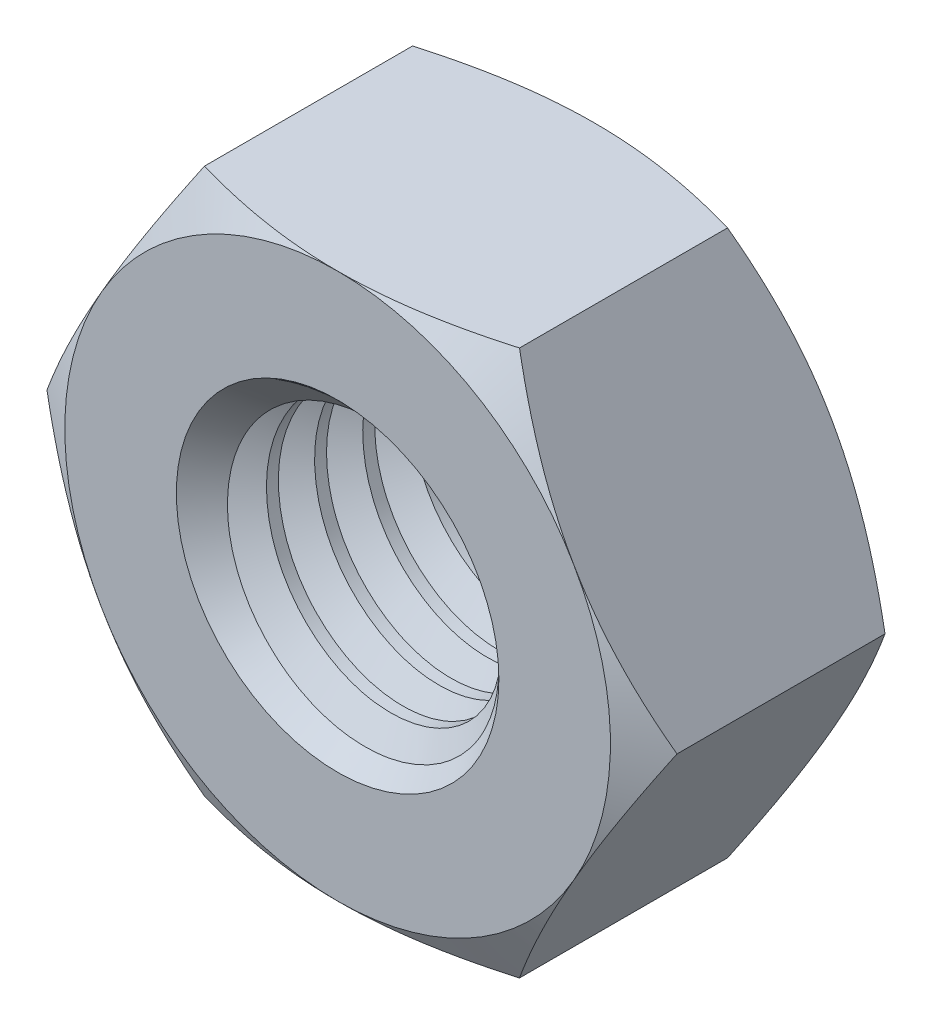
SolidWorks part; units mm, degrees
ref_plane "Front" through (0, 0, 0) normal (0, 0, 1) x (1, 0, 0)
ref_plane "Top" through (0, 0, 0) normal (0, 1, 0) x (1, 0, 0)
ref_plane "Right" through (0, 0, 0) normal (1, 0, 0) x (0, 0, -1)
sketch "Çizim1" plane through (0, 0, 0) normal (0, 0, 1) x (1, 0, 0)
  line L1 (9.815, 0) -> (4.9075, 8.5)
  line L2 (4.9075, 8.5) -> (-4.9075, 8.5)
  line L3 (-4.9075, 8.5) -> (-9.815, 0)
  line L4 (-9.815, 0) -> (-4.9075, -8.5)
  line L5 (-4.9075, -8.5) -> (4.9075, -8.5)
  line L6 (4.9075, -8.5) -> (9.815, 0)
  circle A0 centre (0, 0) radius 8.5 construction
  dimension "D1" = 17
extrude "Yükseklik-Ekstrüzyon1" add sketch "Çizim1" along normal blind 8
sketch "Çizim2" plane through (0, 0, 8) normal (0, 0, 1) x (1, 0, 0)
  circle A0 centre (0, 0) radius 8.5
extrude "Kes-Ekstrüzyon1" cut sketch "Çizim2" against normal blind 8 draft 60 flip side to cut
sketch "Çizim3" plane through (0, 0, 0) normal (0, 0, -1) x (-1, 0, 0)
  circle A0 centre (0, 0) radius 8.5
extrude "Kes-Ekstrüzyon2" cut sketch "Çizim3" against normal blind 8 draft 60 flip side to cut
sketch "Çizim4" plane through (0, 0, 0) normal (0, 0, -1) x (-1, 0, 0)
  circle A0 centre (0, 0) radius 4.025
  dimension "D1" = 8.05
extrude "Kes-Ekstrüzyon3" cut sketch "Çizim4" against normal blind 28
sketch "Çizim5" plane through (0, 0, 0) normal (0, 0, -1) x (-1, 0, 0)
  circle A0 centre (0, 0) radius 4.025
curve "Helis/Spiral1"
ref_plane "Düzlem1" through (-2.0125, -3.4858, 10) normal (0.8645, -0.4991, 0.0592) x (0.0513, -0.0296, -0.9982)
chamfer "Pah1" distance 1 angle 45 2 edges at (-4.025, 0, 0) (4.025, 0, 8)
sketch "Çizim6" plane through (-2.0125, -3.4858, 10) normal (0.8645, -0.4991, 0.0592) x (0.0513, -0.0296, -0.9982)
  line L0 (0.7416, 0.3096) -> (-0.7416, 0.3096)
  line L1 (0, -0.975) -> (0.7416, 0.3096)
  line L3 (-0.7416, 0.3096) -> (0, -0.975)
  line L5 (0, 0.4875) -> (-0.8444, 0.4875)
  circle A0 centre (0, 0) radius 0.4875 construction
  dimension "D1" = 0.975
sweep "Kes-Süpür1" cut profiles "Çizim6" path "Helis/Spiral1"
